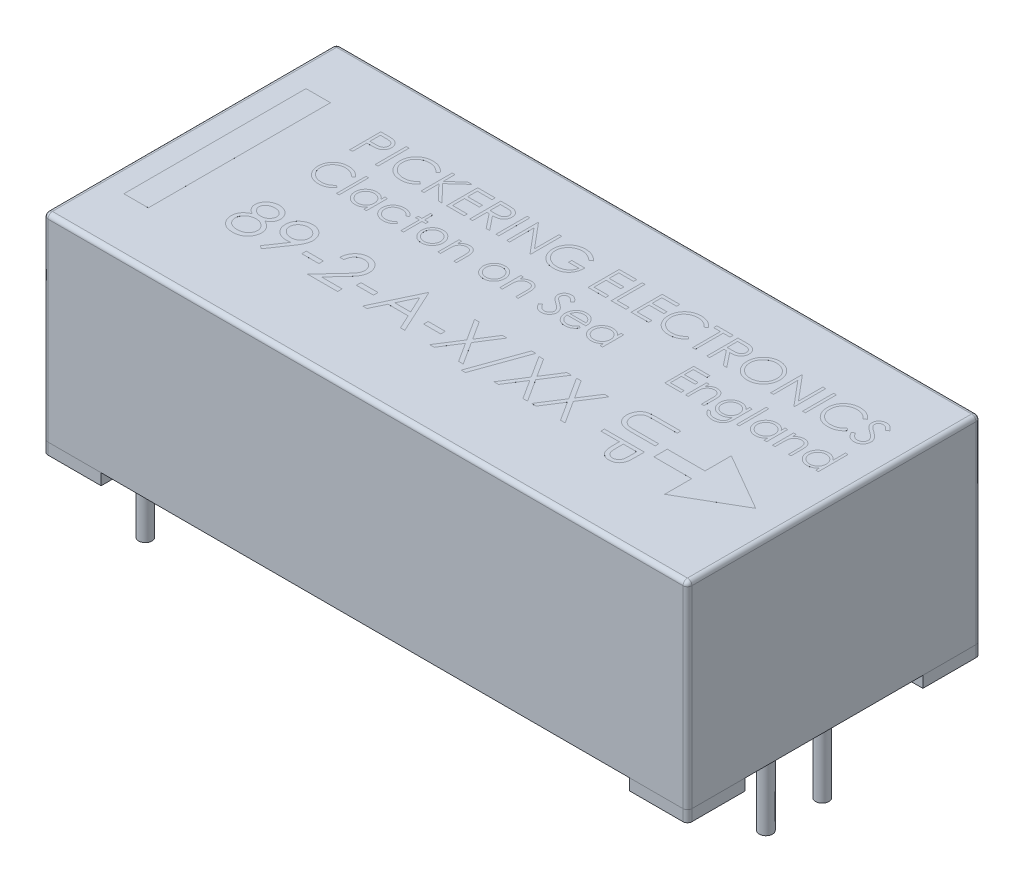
SolidWorks part; units mm, degrees
ref_plane "Front Plane" through (0, 0, 0) normal (0, 0, 1) x (1, 0, 0)
ref_plane "Top Plane" through (0, 0, 0) normal (0, 1, 0) x (1, 0, 0)
ref_plane "Right Plane" through (0, 0, 0) normal (1, 0, 0) x (0, 0, -1)
sketch "Sketch2" plane through (0, 0, 0) normal (0, 1, 0) x (1, 0, 0)
  line L1 (14.5, -6.6) -> (-14.5, -6.6)
  line L2 (14.5, -6.6) -> (14.5, 6.6)
  line L3 (14.5, 6.6) -> (-14.5, 6.6)
  line L4 (-14.5, -6.6) -> (-14.5, 6.6)
  line L5 (14.5, -6.6) -> (-14.5, 6.6) construction
  line L6 (14.5, 6.6) -> (-14.5, -6.6) construction
  point P0 (0, 0)
  dimension "D1" = 13.2
  dimension "D2" = 29
extrude "Main Body" add sketch "Sketch2" along normal blind 8.89 draft 0.023
sketch "Sketch9" plane through (0, 0, 0) normal (0, -1, 0) x (1, 0, 0)
  line L0 (-14.5, -6.6) -> (-14.5, 6.6) construction
  line L2 (14.5, -6.6) -> (-14.5, -6.6) construction
  circle A0 centre (-12.7, -3.81) radius 0.3
  circle A1 centre (-12.7, -1.27) radius 0.2963
  circle A2 centre (-12.7, 1.27) radius 0.3
  circle A3 centre (-12.7, 3.81) radius 0.3
  dimension "D1" = 0.6
  dimension "D5" = 0.6
  dimension "D7" = 0.6
  dimension "D2" = 5.33
  dimension "D3" = 1.8
  dimension "D6" = 2.54
  dimension "D8" = 2.54
extrude "Left hand Pins" add sketch "Sketch9" along normal blind 4.31
sketch "Sketch10" plane through (0, 0, 0) normal (0, -1, 0) x (1, 0, 0)
  line L1 (14.5, 6.6) -> (11.9, 6.6)
  line L2 (14.5, 6.6) -> (14.5, 4)
  line L3 (14.5, 4) -> (11.9, 4)
  line L4 (11.9, 6.6) -> (11.9, 4)
  dimension "D1" = 2.6
  dimension "D2" = 2.6
extrude "Foot" add sketch "Sketch10" along normal blind 0.51
sketch "Sketch11" plane through (0, -0.51, 0) normal (0, -1, 0) x (1, 0, 0)
  line L0 (14.5, 6.6) -> (11.9, 6.6) construction
  line L1 (11.9, 4) -> (13.95, 4)
  line L2 (11.9, 4) -> (11.9, 6.05)
  line L3 (11.9, 6.05) -> (13.95, 6.05)
  line L4 (13.95, 4) -> (13.95, 6.05)
  line L5 (14.5, 4) -> (14.5, 6.6) construction
  dimension "D1" = 0.55
  dimension "D2" = 0.55
extrude "foot cut" cut sketch "Sketch11" against normal up to surface (0.51 mm away)
mirror "Mirror3" about plane through (0, 0, 0) normal (0, 0, 1) of "foot cut", "Foot"
mirror "Mirror4" about plane through (0, 0, 0) normal (1, 0, 0) of "Mirror3", "Foot", "foot cut"
sketch "Sketch12"
  dimension "D1" = 1.1
  dimension "D2" = 8.2
  dimension "D3" = 2.4965
  dimension "D4" = 1.4
  dimension "D5" = 2
  dimension "D6" = 3.8
extrude "Lettering" add sketch "Sketch12" along normal blind 0.0001
sketch "Sketch13" plane through (0, 0, 0) normal (0, -1, 0) x (1, 0, 0)
  line L0 (-11.9, 6.6) -> (11.9, 6.6) construction
  line L2 (14.5, 4) -> (14.5, -4) construction
  circle A0 centre (12.7, 1.27) radius 0.3
  circle A1 centre (12.7, -1.27) radius 0.3
  dimension "D1" = 0.6
  dimension "D2" = 0.6
  dimension "D3" = 2.54
  dimension "D4" = 5.33
  dimension "D5" = 1.8
extrude "Right hand pins" add sketch "Sketch13" along normal blind 4.31
fillet "Fillet1" radius 0.2 12 edges at (14.5, -0.255, -6.6) (-14.5, -0.255, -6.6) (14.5, -0.255, 6.6) (-14.5, -0.255, 6.6) (14.4983, 4.445, -6.5983) (-14.4983, 4.445, -6.5983) (-14.4965, 8.89, 0) (0, 8.89, -6.5965) (14.4965, 8.89, 0) (14.4983, 4.445, 6.5983) (-14.4983, 4.445, 6.5983) (0, 8.89, 6.5965)
sketch "Sketch14"
sketch_block_instance "UP-1"
sketch_block "UP"
sketch_block_instance "Block1-1"
sketch_block "Block1" parameters "D1"=1.7, "D2"=2.2, "D3"=2.6, "D4"=1.24
extrude "Extrude1" add sketch "Sketch14" along normal blind 0.0001
